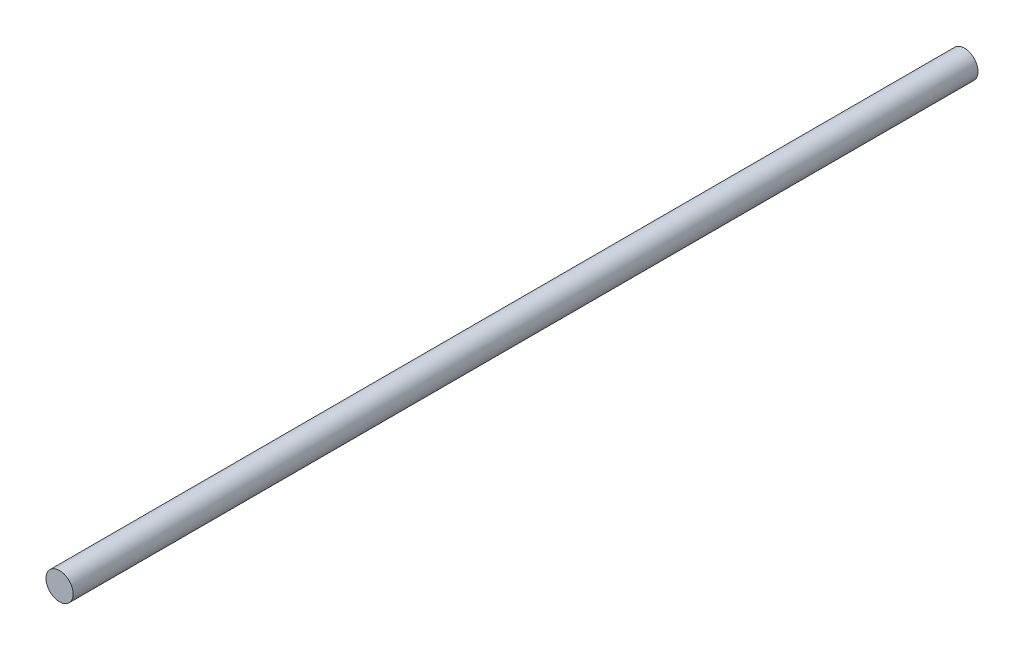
SolidWorks part; units mm, degrees
ref_plane "Front Plane" through (0, 0, 0) normal (0, 0, 1) x (1, 0, 0)
ref_plane "Top Plane" through (0, 0, 0) normal (0, 1, 0) x (1, 0, 0)
ref_plane "Right Plane" through (0, 0, 0) normal (1, 0, 0) x (0, 0, -1)
sketch "Sketch1" plane through (0, 0, 0) normal (0, 0, 1) x (1, 0, 0)
  circle A0 centre (-471.3712, 77.833) radius 6
extrude "Boss-Extrude1" add sketch "Sketch1" along normal blind 400
